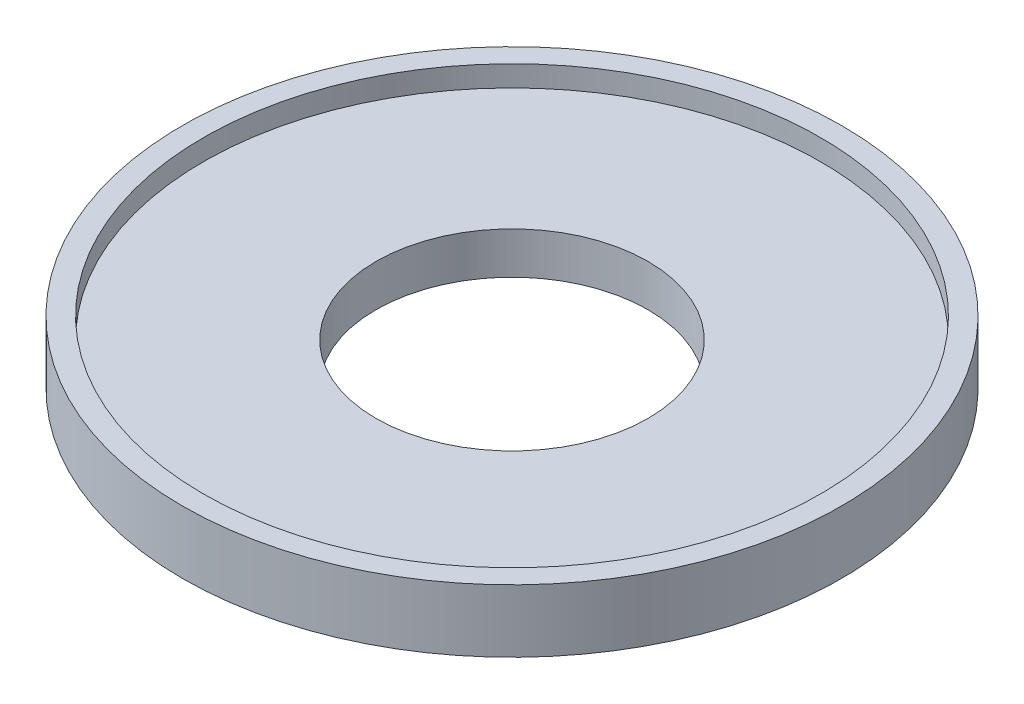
SolidWorks part; units mm, degrees
ref_plane "Płaszczyzna przednia" through (0, 0, 0) normal (0, 0, 1) x (1, 0, 0)
ref_plane "Płaszczyzna górna" through (0, 0, 0) normal (0, 1, 0) x (1, 0, 0)
ref_plane "Płaszczyzna prawa" through (0, 0, 0) normal (1, 0, 0) x (0, 0, -1)
sketch "Szkic1" plane through (0, 0, 0) normal (0, 1, 0) x (1, 0, 0)
  circle A0 centre (0, 0) radius 31.5
extrude "Dodanie-wyciągnięcie1" add sketch "Szkic1" along normal blind 6
sketch "Szkic2" plane through (0, 6, 0) normal (0, 1, 0) x (1, 0, 0)
  circle A0 centre (0, 0) radius 13
extrude "Wytnij-wyciągnięcie1" cut sketch "Szkic2" against normal blind 6
sketch "Szkic3" plane through (0, 6, 0) normal (0, 1, 0) x (1, 0, 0)
  circle A0 centre (0, 0) radius 29.5
  circle A1 centre (0, 0) radius 31.5 construction
  dimension "D1" = 2
extrude "Wytnij-wyciągnięcie2" cut sketch "Szkic3" against normal blind 2
